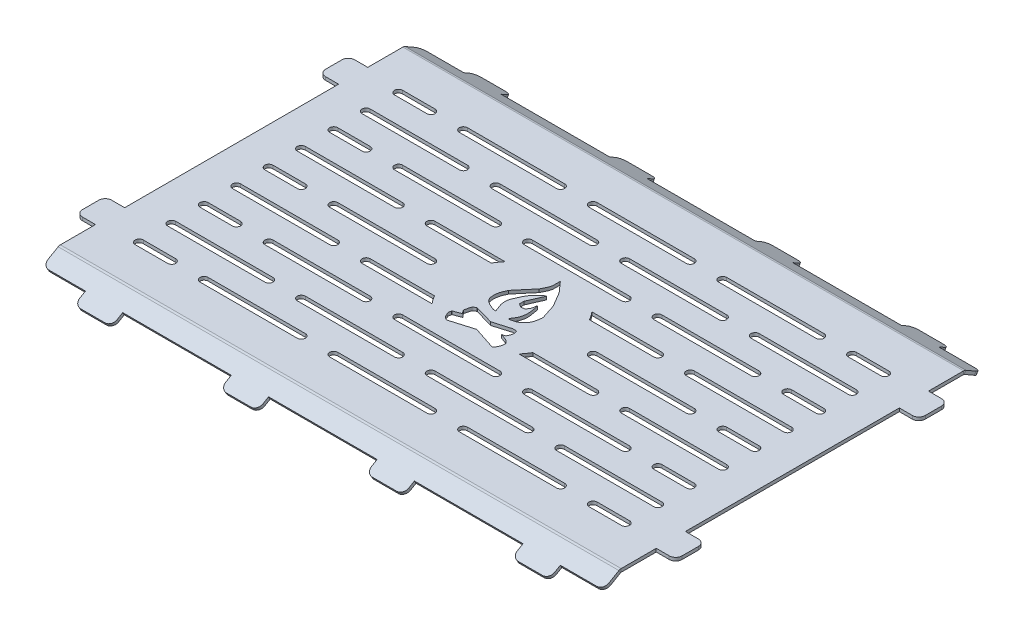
SolidWorks part; units mm, degrees
ref_plane "Ön Düzlem" through (0, 0, 0) normal (0, 0, 1) x (1, 0, 0)
ref_plane "Üst Düzlem" through (0, 0, 0) normal (0, 1, 0) x (1, 0, 0)
ref_plane "Sağ Düzlem" through (0, 0, 0) normal (1, 0, 0) x (0, 0, -1)
sketch "Çizim1" plane through (0, 0, 0) normal (0, 1, 0) x (1, 0, 0)
  line L1 (0, 0) -> (346, 0)
  line L2 (0, 0) -> (0, 237)
  line L3 (0, 237) -> (346, 237)
  line L4 (346, 0) -> (346, 237)
  dimension "D1" = 346
  dimension "D2" = 237
base flange "Taban-Flanş1" sketch "Çizim1" thickness 2 reverse thickness direction no parameters "D1"=0.7432
sketch "Çizim6" plane through (0, 0, 0) normal (0, 1, 0) x (1, 0, 0)
  line L0 (173, 237) -> (173, 0) construction
  line L1 (346, 237) -> (0, 237) construction
  line L2 (0, 0) -> (346, 0) construction
  line L3 (116.5, 237) -> (116.5, 245)
  line L4 (26.5, 237) -> (49.5, 237)
  line L5 (26.5, 237) -> (26.5, 245)
  line L6 (26.5, 245) -> (49.5, 245)
  line L7 (49.5, 237) -> (49.5, 245)
  line L8 (116.5, 237) -> (139.5, 237)
  line L9 (139.5, 237) -> (139.5, 245)
  line L10 (116.5, 245) -> (139.5, 245)
  line L11 (206.5, 237) -> (206.5, 245)
  line L12 (206.5, 237) -> (229.5, 237)
  line L13 (229.5, 237) -> (229.5, 245)
  line L14 (206.5, 245) -> (229.5, 245)
  line L15 (296.5, 237) -> (296.5, 245)
  line L16 (296.5, 237) -> (319.5, 237)
  line L17 (319.5, 237) -> (319.5, 245)
  line L18 (296.5, 245) -> (319.5, 245)
  line L19 (0, 237) -> (0, 0) construction
  line L20 (0, 202.5) -> (-12, 202.5)
  line L21 (0, 202.5) -> (0, 184.5)
  line L22 (0, 184.5) -> (-12, 184.5)
  line L23 (-12, 202.5) -> (-12, 184.5)
  line L24 (0, 118.5) -> (346, 118.5) construction
  line L25 (346, 0) -> (346, 237) construction
  line L26 (346, 184.5) -> (358, 184.5)
  line L27 (358, 202.5) -> (358, 184.5)
  line L28 (346, 202.5) -> (358, 202.5)
  line L29 (346, 202.5) -> (346, 184.5)
  line L30 (26.5, -8) -> (49.5, -8)
  line L31 (49.5, 0) -> (49.5, -8)
  line L32 (26.5, 0) -> (49.5, 0)
  line L33 (26.5, 0) -> (26.5, -8)
  line L34 (0, 52.5) -> (-12, 52.5)
  line L35 (-12, 34.5) -> (-12, 52.5)
  line L36 (0, 34.5) -> (-12, 34.5)
  line L37 (0, 34.5) -> (0, 52.5)
  line L38 (116.5, 0) -> (139.5, 0)
  line L39 (139.5, 0) -> (139.5, -8)
  line L40 (116.5, -8) -> (139.5, -8)
  line L41 (116.5, 0) -> (116.5, -8)
  line L42 (206.5, 0) -> (229.5, 0)
  line L43 (229.5, 0) -> (229.5, -8)
  line L44 (206.5, -8) -> (229.5, -8)
  line L45 (206.5, 0) -> (206.5, -8)
  line L46 (296.5, 0) -> (319.5, 0)
  line L47 (319.5, 0) -> (319.5, -8)
  line L48 (296.5, -8) -> (319.5, -8)
  line L49 (296.5, 0) -> (296.5, -8)
  line L50 (346, 34.5) -> (346, 52.5)
  line L51 (346, 34.5) -> (358, 34.5)
  line L52 (358, 34.5) -> (358, 52.5)
  line L53 (346, 52.5) -> (358, 52.5)
  point P10 (128, 245)
  point P11 (218, 245)
  point P34 (-12, 193.5)
  dimension "D1" = 23
  dimension "D2" = 8
  dimension "D4" = 90
  dimension "D5" = 45
  dimension "D6" = 18
  dimension "D7" = 12
  dimension "D8" = 150
  dimension "D3" = 4
base flange "Sekme1" sketch "Çizim6" thickness 2 reverse thickness direction no parameters "D1"=0.7432
break corner "Köşeleri kır1" thickness 2 parameters "D1"=4, "D0"=4, "D7"=5
sketch "Çizim9" plane through (0, 0, 0) normal (0, 1, 0) x (1, 0, 0)
  line L0 (0, 118.5) -> (346, 118.5) construction
  line L1 (0, 184.5) -> (0, 52.5) construction
  line L2 (346, 52.5) -> (346, 184.5) construction
  line L3 (173, 237) -> (173, 0) construction
  line L4 (206.5, 237) -> (139.5, 237) construction
  line L5 (139.5, 0) -> (206.5, 0) construction
  line L6 (296.5, 237) -> (229.5, 237) construction
  line L7 (30, 207) -> (316, 207) construction
  line L8 (30, 207) -> (30, 30) construction
  line L9 (30, 30) -> (316, 30) construction
  line L10 (316, 207) -> (316, 30) construction
  line L11 (30, 207) -> (316, 30) construction
  line L12 (30, 30) -> (316, 207) construction
  line L13 (30, 167) -> (70, 207) construction
  line L14 (26.4645, 170.5355) -> (66.4645, 210.5355)
  line L15 (33.5355, 163.4645) -> (73.5355, 203.4645)
  line L16 (79.2, 167) -> (119.2, 207) construction
  line L17 (75.6645, 170.5355) -> (115.6645, 210.5355)
  line L18 (82.7355, 163.4645) -> (122.7355, 203.4645)
  line L19 (128.4, 167) -> (168.4, 207) construction
  line L20 (124.8645, 170.5355) -> (164.8645, 210.5355)
  line L21 (131.9355, 163.4645) -> (171.9355, 203.4645)
  line L22 (177.6, 167) -> (217.6, 207) construction
  line L23 (174.0645, 170.5355) -> (214.0645, 210.5355)
  line L24 (181.1355, 163.4645) -> (221.1355, 203.4645)
  line L25 (226.8, 167) -> (266.8, 207) construction
  line L26 (223.2645, 170.5355) -> (263.2645, 210.5355)
  line L27 (230.3355, 163.4645) -> (270.3355, 203.4645)
  line L28 (276, 167) -> (316, 207) construction
  line L29 (272.4645, 170.5355) -> (312.4645, 210.5355)
  line L30 (279.5355, 163.4645) -> (319.5355, 203.4645)
  line L31 (30, 70) -> (70, 30) construction
  line L32 (26.4645, 66.4645) -> (66.4645, 26.4645)
  line L33 (33.5355, 73.5355) -> (73.5355, 33.5355)
  line L34 (79.2, 70) -> (119.2, 30) construction
  line L35 (75.6645, 66.4645) -> (115.6645, 26.4645)
  line L36 (82.7355, 73.5355) -> (122.7355, 33.5355)
  line L37 (128.4, 70) -> (168.4, 30) construction
  line L38 (124.8645, 66.4645) -> (164.8645, 26.4645)
  line L39 (131.9355, 73.5355) -> (171.9355, 33.5355)
  line L40 (177.6, 70) -> (217.6, 30) construction
  line L41 (174.0645, 66.4645) -> (214.0645, 26.4645)
  line L42 (181.1355, 73.5355) -> (221.1355, 33.5355)
  line L43 (226.8, 70) -> (266.8, 30) construction
  line L44 (223.2645, 66.4645) -> (263.2645, 26.4645)
  line L45 (230.3355, 73.5355) -> (270.3355, 33.5355)
  line L46 (276, 70) -> (316, 30) construction
  line L47 (272.4645, 66.4645) -> (312.4645, 26.4645)
  line L48 (279.5355, 73.5355) -> (319.5355, 33.5355)
  line L57 (30, 138.5) -> (50, 118.5) construction
  line L58 (50, 118.5) -> (30, 98.5) construction
  line L59 (30, 98.5) -> (30, 138.5) construction
  line L60 (33.5355, 142.0355) -> (53.5355, 122.0355)
  line L61 (26.4645, 134.9645) -> (39.3934, 122.0355)
  line L62 (33.5355, 94.9645) -> (53.5355, 114.9645)
  line L63 (26.4645, 102.0355) -> (39.3934, 114.9645)
  line L64 (86.7355, 94.9645) -> (106.7355, 114.9645)
  line L65 (79.6645, 102.0355) -> (92.5934, 114.9645)
  line L66 (79.6645, 134.9645) -> (92.5934, 122.0355)
  line L67 (86.7355, 142.0355) -> (106.7355, 122.0355)
  line L68 (139.9355, 94.9645) -> (159.9355, 114.9645)
  line L69 (132.8645, 102.0355) -> (145.7934, 114.9645)
  line L70 (132.8645, 134.9645) -> (145.7934, 122.0355)
  line L71 (139.9355, 142.0355) -> (159.9355, 122.0355)
  line L72 (193.1355, 94.9645) -> (213.1355, 114.9645)
  line L73 (186.0645, 102.0355) -> (198.9934, 114.9645)
  line L74 (186.0645, 134.9645) -> (198.9934, 122.0355)
  line L75 (193.1355, 142.0355) -> (213.1355, 122.0355)
  line L76 (246.3355, 94.9645) -> (266.3355, 114.9645) construction
  line L77 (239.2645, 102.0355) -> (252.1934, 114.9645) construction
  line L78 (239.2645, 134.9645) -> (252.1934, 122.0355) construction
  line L79 (246.3355, 142.0355) -> (266.3355, 122.0355) construction
  line L80 (299.5355, 94.9645) -> (319.5355, 114.9645) construction
  line L81 (292.4645, 102.0355) -> (305.3934, 114.9645) construction
  line L82 (292.4645, 134.9645) -> (305.3934, 122.0355) construction
  line L83 (299.5355, 142.0355) -> (319.5355, 122.0355) construction
  line L84 (266.3355, 102.0355) -> (253.4066, 114.9645)
  line L85 (266.3355, 134.9645) -> (253.4066, 122.0355)
  line L86 (259.2645, 142.0355) -> (239.2645, 122.0355)
  line L87 (259.2645, 94.9645) -> (239.2645, 114.9645)
  line L88 (312.4645, 142.0355) -> (292.4645, 122.0355)
  line L89 (319.5355, 134.9645) -> (306.6066, 122.0355)
  line L90 (319.5355, 102.0355) -> (306.6066, 114.9645)
  line L91 (312.4645, 94.9645) -> (292.4645, 114.9645)
  arc A0 (26.4645, 170.5355) -> (33.5355, 163.4645) centre (30, 167) ccw
  arc A1 (73.5355, 203.4645) -> (66.4645, 210.5355) centre (70, 207) ccw
  arc A2 (75.6645, 170.5355) -> (82.7355, 163.4645) centre (79.2, 167) ccw
  arc A3 (122.7355, 203.4645) -> (115.6645, 210.5355) centre (119.2, 207) ccw
  arc A4 (124.8645, 170.5355) -> (131.9355, 163.4645) centre (128.4, 167) ccw
  arc A5 (171.9355, 203.4645) -> (164.8645, 210.5355) centre (168.4, 207) ccw
  arc A6 (174.0645, 170.5355) -> (181.1355, 163.4645) centre (177.6, 167) ccw
  arc A7 (221.1355, 203.4645) -> (214.0645, 210.5355) centre (217.6, 207) ccw
  arc A8 (223.2645, 170.5355) -> (230.3355, 163.4645) centre (226.8, 167) ccw
  arc A9 (270.3355, 203.4645) -> (263.2645, 210.5355) centre (266.8, 207) ccw
  arc A10 (272.4645, 170.5355) -> (279.5355, 163.4645) centre (276, 167) ccw
  arc A11 (319.5355, 203.4645) -> (312.4645, 210.5355) centre (316, 207) ccw
  arc A12 (26.4645, 66.4645) -> (33.5355, 73.5355) centre (30, 70) cw
  arc A13 (73.5355, 33.5355) -> (66.4645, 26.4645) centre (70, 30) cw
  arc A14 (75.6645, 66.4645) -> (82.7355, 73.5355) centre (79.2, 70) cw
  arc A15 (122.7355, 33.5355) -> (115.6645, 26.4645) centre (119.2, 30) cw
  arc A16 (124.8645, 66.4645) -> (131.9355, 73.5355) centre (128.4, 70) cw
  arc A17 (171.9355, 33.5355) -> (164.8645, 26.4645) centre (168.4, 30) cw
  arc A18 (174.0645, 66.4645) -> (181.1355, 73.5355) centre (177.6, 70) cw
  arc A19 (221.1355, 33.5355) -> (214.0645, 26.4645) centre (217.6, 30) cw
  arc A20 (223.2645, 66.4645) -> (230.3355, 73.5355) centre (226.8, 70) cw
  arc A21 (270.3355, 33.5355) -> (263.2645, 26.4645) centre (266.8, 30) cw
  arc A22 (272.4645, 66.4645) -> (279.5355, 73.5355) centre (276, 70) cw
  arc A23 (319.5355, 33.5355) -> (312.4645, 26.4645) centre (316, 30) cw
  circle A28 centre (30, 138.5) radius 5 construction
  circle A29 centre (50, 118.5) radius 5 construction
  arc A30 (26.4645, 134.9645) -> (33.5355, 142.0355) centre (30, 138.5) cw
  arc A31 (26.4645, 102.0355) -> (33.5355, 94.9645) centre (30, 98.5) ccw
  arc A32 (53.5355, 122.0355) -> (53.5355, 114.9645) centre (50, 118.5) cw
  arc A33 (39.3934, 114.9645) -> (39.3934, 122.0355) centre (35.8579, 118.5) ccw
  arc A34 (106.7355, 122.0355) -> (106.7355, 114.9645) centre (103.2, 118.5) cw
  arc A35 (79.6645, 102.0355) -> (86.7355, 94.9645) centre (83.2, 98.5) ccw
  arc A36 (92.5934, 114.9645) -> (92.5934, 122.0355) centre (89.0579, 118.5) ccw
  arc A37 (79.6645, 134.9645) -> (86.7355, 142.0355) centre (83.2, 138.5) cw
  arc A38 (159.9355, 122.0355) -> (159.9355, 114.9645) centre (156.4, 118.5) cw
  arc A39 (132.8645, 102.0355) -> (139.9355, 94.9645) centre (136.4, 98.5) ccw
  arc A40 (145.7934, 114.9645) -> (145.7934, 122.0355) centre (142.2579, 118.5) ccw
  arc A41 (132.8645, 134.9645) -> (139.9355, 142.0355) centre (136.4, 138.5) cw
  arc A42 (213.1355, 122.0355) -> (213.1355, 114.9645) centre (209.6, 118.5) cw
  arc A43 (186.0645, 102.0355) -> (193.1355, 94.9645) centre (189.6, 98.5) ccw
  arc A44 (198.9934, 114.9645) -> (198.9934, 122.0355) centre (195.4579, 118.5) ccw
  arc A45 (186.0645, 134.9645) -> (193.1355, 142.0355) centre (189.6, 138.5) cw
  arc A46 (266.3355, 122.0355) -> (266.3355, 114.9645) centre (262.8, 118.5) cw construction
  arc A47 (239.2645, 102.0355) -> (246.3355, 94.9645) centre (242.8, 98.5) ccw construction
  arc A48 (252.1934, 114.9645) -> (252.1934, 122.0355) centre (248.6579, 118.5) ccw construction
  arc A49 (239.2645, 134.9645) -> (246.3355, 142.0355) centre (242.8, 138.5) cw construction
  arc A50 (319.5355, 122.0355) -> (319.5355, 114.9645) centre (316, 118.5) cw construction
  arc A51 (292.4645, 102.0355) -> (299.5355, 94.9645) centre (296, 98.5) ccw construction
  arc A52 (305.3934, 114.9645) -> (305.3934, 122.0355) centre (301.8579, 118.5) ccw construction
  arc A53 (292.4645, 134.9645) -> (299.5355, 142.0355) centre (296, 138.5) cw construction
  arc A54 (266.3355, 102.0355) -> (259.2645, 94.9645) centre (262.8, 98.5) cw
  arc A55 (253.4066, 114.9645) -> (253.4066, 122.0355) centre (256.9421, 118.5) cw
  arc A56 (266.3355, 134.9645) -> (259.2645, 142.0355) centre (262.8, 138.5) ccw
  arc A57 (239.2645, 122.0355) -> (239.2645, 114.9645) centre (242.8, 118.5) ccw
  arc A58 (319.5355, 134.9645) -> (312.4645, 142.0355) centre (316, 138.5) ccw
  arc A59 (306.6066, 114.9645) -> (306.6066, 122.0355) centre (310.1421, 118.5) cw
  arc A60 (319.5355, 102.0355) -> (312.4645, 94.9645) centre (316, 98.5) cw
  arc A61 (292.4645, 122.0355) -> (292.4645, 114.9645) centre (296, 118.5) ccw
  point P12 (173, 118.5)
  point P21 (50, 187)
  point P30 (99.2, 187)
  point P37 (148.4, 187)
  point P44 (197.6, 187)
  point P51 (246.8, 187)
  point P58 (296, 187)
  point P64 (50, 50)
  point P71 (99.2, 50)
  point P78 (148.4, 50)
  point P85 (197.6, 50)
  point P92 (246.8, 50)
  point P98 (296, 50)
  point P118 (42.9289, 118.5)
  point P183 (316, 118.5)
  dimension "D5" = 5
  dimension "D7" = 10
  dimension "D9" = 5
  dimension "D1" = 30
  dimension "D2" = 30
  dimension "D3" = 40
  dimension "D4" = 40
  dimension "D8" = 40
  dimension "D6" = 6
  dimension "D10" = 6
extrude "Kes-Ekstrüzyon1" cut sketch "Çizim9" against normal blind 10
sketch "Çizim10" plane through (0, 0, 0) normal (0, 1, 0) x (1, 0, 0)
  line L0 (346, 52.5) -> (346, 184.5) construction
  line L1 (125, 152) -> (221, 152)
  line L2 (125, 152) -> (125, 85)
  line L3 (125, 85) -> (221, 85)
  line L4 (221, 152) -> (221, 85)
  line L5 (0, 184.5) -> (0, 52.5) construction
  line L6 (206.5, 237) -> (139.5, 237) construction
  line L7 (139.5, 0) -> (206.5, 0) construction
  dimension "D1" = 125
  dimension "D2" = 125
  dimension "D3" = 85
  dimension "D4" = 85
base flange "Sekme2" sketch "Çizim10" thickness 2 reverse thickness direction no parameters "D1"=0.7432
sketch "Çizim13" plane through (0, 0, 0) normal (0, 1, 0) x (1, 0, 0)
  line L8 (0, 118.5) -> (346, 118.5) construction
  line L9 (0, 184.5) -> (0, 52.5) construction
  line L10 (346, 52.5) -> (346, 184.5) construction
  line L11 (173, 237) -> (173, 0) construction
  line L12 (206.5, 237) -> (139.5, 237) construction
  line L13 (139.5, 0) -> (206.5, 0) construction
  line L14 (173, 118.5) -> (197.7487, 143.2487) construction
  line L15 (173, 118.5) -> (184.9707, 151.3892) construction
  circle A5 centre (173, 118.5) radius 35 construction
  arc A6 (205.8892, 130.4707) -> (184.9707, 151.3892) centre (173, 118.5) ccw construction
  arc A11 (207.7686, 131.1547) -> (185.6547, 153.2686) centre (173, 118.5) ccw
  arc A12 (204.0099, 129.7867) -> (184.2867, 149.5099) centre (173, 118.5) ccw
  arc A13 (204.0099, 129.7867) -> (207.7686, 131.1547) centre (205.8892, 130.4707) ccw
  arc A14 (185.6547, 153.2686) -> (184.2867, 149.5099) centre (184.9707, 151.3892) ccw
  arc A15 (184.9707, 85.6108) -> (205.8892, 106.5293) centre (173, 118.5) ccw construction
  arc A16 (185.6547, 83.7314) -> (207.7686, 105.8453) centre (173, 118.5) ccw
  arc A17 (184.2867, 87.4901) -> (204.0099, 107.2133) centre (173, 118.5) ccw
  arc A18 (184.2867, 87.4901) -> (185.6547, 83.7314) centre (184.9707, 85.6108) ccw
  arc A19 (207.7686, 105.8453) -> (204.0099, 107.2133) centre (205.8892, 106.5293) ccw
  arc A20 (140.1108, 106.5293) -> (161.0293, 85.6108) centre (173, 118.5) ccw construction
  arc A21 (138.2314, 105.8453) -> (160.3453, 83.7314) centre (173, 118.5) ccw
  arc A22 (141.9901, 107.2133) -> (161.7133, 87.4901) centre (173, 118.5) ccw
  arc A23 (141.9901, 107.2133) -> (138.2314, 105.8453) centre (140.1108, 106.5293) ccw
  arc A24 (160.3453, 83.7314) -> (161.7133, 87.4901) centre (161.0293, 85.6108) ccw
  arc A25 (161.0293, 151.3892) -> (140.1108, 130.4707) centre (173, 118.5) ccw construction
  arc A26 (160.3453, 153.2686) -> (138.2314, 131.1547) centre (173, 118.5) ccw
  arc A27 (161.7133, 149.5099) -> (141.9901, 129.7867) centre (173, 118.5) ccw
  arc A28 (161.7133, 149.5099) -> (160.3453, 153.2686) centre (161.0293, 151.3892) ccw
  arc A29 (138.2314, 131.1547) -> (141.9901, 129.7867) centre (140.1108, 130.4707) ccw
  point P17 (197.7487, 143.2487)
  point P25 (173, 118.5)
  point P30 (197.7487, 93.7513)
  point P37 (148.2513, 93.7513)
  point P44 (148.2513, 143.2487)
  point P49 (173, 118.5)
  dimension "D1" = 70
  dimension "D2" = 45
  dimension "D3" = 2
  dimension "D4" = 25
  dimension "D5" = 4
sketch_block_instance "Blok1-1"
sketch_block "Blok1" parameters "D1"=3
extrude "Kes-Ekstrüzyon2" [suppressed] cut sketch "Çizim13" against normal blind 10
sketch "Çizim15" plane through (0, 0, 0) normal (0, 1, 0) x (1, 0, 0)
  line L0 (0, 118.5) -> (346, 118.5) construction
  line L1 (0, 184.5) -> (0, 52.5) construction
  line L2 (346, 52.5) -> (346, 184.5) construction
  line L3 (173, 237) -> (173, 0) construction
  line L4 (206.5, 237) -> (139.5, 237) construction
  line L5 (139.5, 0) -> (206.5, 0) construction
  line L6 (173, 118.5) -> (211.3022, 86.3606) construction
  circle A0 centre (173, 118.5) radius 50 construction
  arc A1 (211.3022, 86.3606) -> (211.3022, 150.6394) centre (173, 118.5) ccw construction
  arc A2 (213.2173, 84.7537) -> (213.2173, 152.2463) centre (173, 118.5) ccw
  arc A3 (209.3871, 87.9676) -> (209.3871, 149.0324) centre (173, 118.5) ccw
  arc A4 (209.3871, 87.9676) -> (213.2173, 84.7537) centre (211.3022, 86.3606) ccw
  arc A5 (213.2173, 152.2463) -> (209.3871, 149.0324) centre (211.3022, 150.6394) ccw
  arc A6 (134.6978, 86.3606) -> (134.6978, 150.6394) centre (173, 118.5) cw construction
  arc A7 (132.7827, 84.7537) -> (132.7827, 152.2463) centre (173, 118.5) cw
  arc A8 (136.6129, 87.9676) -> (136.6129, 149.0324) centre (173, 118.5) cw
  arc A9 (136.6129, 87.9676) -> (132.7827, 84.7537) centre (134.6978, 86.3606) cw
  arc A10 (132.7827, 152.2463) -> (136.6129, 149.0324) centre (134.6978, 150.6394) cw
  point P16 (223, 118.5)
  point P24 (123, 118.5)
  dimension "D1" = 100
  dimension "D2" = 2.5
  dimension "D3" = 40
extrude "Kes-Ekstrüzyon4" [suppressed] cut sketch "Çizim15" against normal blind 10
sketch "Çizim14" plane through (0, 0, 0) normal (0, 1, 0) x (1, 0, 0)
  line L0 (0, 118.5) -> (346, 118.5) construction
  line L1 (0, 0) -> (0, 237) construction
  line L2 (346, 52.5) -> (346, 184.5) construction
  line L3 (15, 153.5) -> (15, 83.5) construction
  line L4 (0, 184.5) -> (0, 52.5) construction
  line L5 (173, 237) -> (173, 0) construction
  line L6 (206.5, 237) -> (139.5, 237) construction
  line L7 (139.5, 0) -> (206.5, 0) construction
  circle A0 centre (15, 153.5) radius 4
  circle A1 centre (15, 83.5) radius 4
  circle A2 centre (331, 153.5) radius 4
  circle A3 centre (331, 83.5) radius 4
  point P9 (15, 118.5)
  dimension "D1" = 8
  dimension "D3" = 15
  dimension "D2" = 70
extrude "Kes-Ekstrüzyon3" [suppressed] cut sketch "Çizim14" against normal blind 10
sketch "Çizim16" plane through (0, 0, 0) normal (0, 1, 0) x (1, 0, 0)
  line L1 (22.8543, 224.6637) -> (329.0665, 224.6637)
  line L2 (22.8543, 224.6637) -> (22.8543, 159.7932)
  line L3 (22.8543, 159.7932) -> (329.0665, 159.7932)
  line L4 (329.0665, 224.6637) -> (329.0665, 159.7932)
  line L5 (22.8543, 78.4429) -> (324.2831, 78.4429)
  line L6 (22.8543, 78.4429) -> (22.8543, 17.605)
  line L7 (22.8543, 17.605) -> (324.2831, 17.605)
  line L8 (324.2831, 78.4429) -> (324.2831, 17.605)
  line L9 (233.0263, 152.2314) -> (324.2831, 152.2314)
  line L10 (233.0263, 152.2314) -> (233.0263, 86.8759)
  line L11 (233.0263, 86.8759) -> (324.2831, 86.8759)
  line L12 (324.2831, 152.2314) -> (324.2831, 86.8759)
  line L13 (22.8543, 148.3161) -> (109.8446, 148.3161)
  line L14 (22.8543, 148.3161) -> (22.8543, 90.7912)
  line L15 (22.8543, 90.7912) -> (109.8446, 90.7912)
  line L16 (109.8446, 148.3161) -> (109.8446, 90.7912)
base flange "Sekme3" sketch "Çizim16" thickness 2 reverse thickness direction no parameters "D1"=0.7432
sketch "Çizim19" plane through (0, 0, 0) normal (0, 1, 0) x (1, 0, 0)
  line L0 (23, 218.5) -> (83, 218.5) construction
  line L1 (23, 221) -> (83, 221)
  line L2 (23, 216) -> (83, 216)
  line L3 (103, 218.5) -> (163, 218.5) construction
  line L4 (103, 221) -> (163, 221)
  line L5 (103, 216) -> (163, 216)
  line L6 (183, 218.5) -> (243, 218.5) construction
  line L7 (183, 221) -> (243, 221)
  line L8 (183, 216) -> (243, 216)
  line L9 (263, 218.5) -> (323, 218.5) construction
  line L10 (263, 221) -> (323, 221)
  line L11 (263, 216) -> (323, 216)
  line L12 (173, 237) -> (173, 0) construction
  line L13 (206.5, 237) -> (139.5, 237) construction
  line L14 (139.5, 0) -> (206.5, 0) construction
  line L15 (0, 118.5) -> (346, 118.5) construction
  line L16 (0, 184.5) -> (0, 52.5) construction
  line L17 (346, 52.5) -> (346, 184.5) construction
  line L18 (63, 198.5) -> (123, 198.5) construction
  line L19 (63, 201) -> (123, 201)
  line L20 (63, 196) -> (123, 196)
  line L21 (143, 198.5) -> (203, 198.5) construction
  line L22 (143, 201) -> (203, 201)
  line L23 (143, 196) -> (203, 196)
  line L24 (223, 198.5) -> (283, 198.5) construction
  line L25 (223, 201) -> (283, 201)
  line L26 (223, 196) -> (283, 196)
  line L27 (23, 178.5) -> (83, 178.5) construction
  line L30 (83, 218.5) -> (103, 218.5) construction
  line L31 (93, 218.5) -> (93, 198.5) construction
  line L32 (23, 181) -> (83, 181)
  line L33 (23, 176) -> (83, 176)
  line L34 (103, 178.5) -> (163, 178.5) construction
  line L35 (103, 181) -> (163, 181)
  line L36 (103, 176) -> (163, 176)
  line L37 (183, 178.5) -> (243, 178.5) construction
  line L38 (183, 181) -> (243, 181)
  line L39 (183, 176) -> (243, 176)
  line L40 (263, 178.5) -> (323, 178.5) construction
  line L41 (263, 181) -> (323, 181)
  line L42 (263, 176) -> (323, 176)
  line L43 (63, 158.5) -> (123, 158.5) construction
  line L44 (63, 161) -> (123, 161)
  line L45 (63, 156) -> (123, 156)
  line L46 (143, 158.5) -> (203, 158.5) construction
  line L47 (143, 161) -> (203, 161)
  line L48 (143, 156) -> (203, 156)
  line L49 (223, 158.5) -> (283, 158.5) construction
  line L50 (223, 161) -> (283, 161)
  line L51 (223, 156) -> (283, 156)
  line L52 (23, 138.5) -> (83, 138.5) construction
  line L53 (23, 141) -> (83, 141)
  line L54 (23, 136) -> (83, 136)
  line L55 (103, 138.5) -> (163, 138.5) construction
  line L56 (103, 141) -> (163, 141)
  line L57 (103, 136) -> (163, 136)
  line L58 (183, 138.5) -> (243, 138.5) construction
  line L59 (183, 141) -> (243, 141)
  line L60 (183, 136) -> (243, 136)
  line L61 (263, 138.5) -> (323, 138.5) construction
  line L62 (263, 141) -> (323, 141)
  line L63 (263, 136) -> (323, 136)
  line L64 (63, 118.5) -> (123, 118.5) construction
  line L65 (63, 121) -> (123, 121)
  line L66 (63, 116) -> (123, 116)
  line L67 (143, 118.5) -> (203, 118.5) construction
  line L68 (143, 121) -> (203, 121)
  line L69 (143, 116) -> (203, 116)
  line L70 (223, 118.5) -> (283, 118.5) construction
  line L71 (223, 121) -> (283, 121)
  line L72 (223, 116) -> (283, 116)
  line L73 (23, 98.5) -> (83, 98.5) construction
  line L74 (23, 101) -> (83, 101)
  line L75 (23, 96) -> (83, 96)
  line L76 (103, 98.5) -> (163, 98.5) construction
  line L77 (103, 101) -> (163, 101)
  line L78 (103, 96) -> (163, 96)
  line L79 (183, 98.5) -> (243, 98.5) construction
  line L80 (183, 101) -> (243, 101)
  line L81 (183, 96) -> (243, 96)
  line L82 (263, 98.5) -> (323, 98.5) construction
  line L83 (263, 101) -> (323, 101)
  line L84 (263, 96) -> (323, 96)
  line L85 (63, 78.5) -> (123, 78.5) construction
  line L86 (63, 81) -> (123, 81)
  line L87 (63, 76) -> (123, 76)
  line L88 (143, 78.5) -> (203, 78.5) construction
  line L89 (143, 81) -> (203, 81)
  line L90 (143, 76) -> (203, 76)
  line L91 (223, 78.5) -> (283, 78.5) construction
  line L92 (223, 81) -> (283, 81)
  line L93 (223, 76) -> (283, 76)
  line L94 (23, 58.5) -> (83, 58.5) construction
  line L95 (23, 61) -> (83, 61)
  line L96 (23, 56) -> (83, 56)
  line L97 (103, 58.5) -> (163, 58.5) construction
  line L98 (103, 61) -> (163, 61)
  line L99 (103, 56) -> (163, 56)
  line L100 (183, 58.5) -> (243, 58.5) construction
  line L101 (183, 61) -> (243, 61)
  line L102 (183, 56) -> (243, 56)
  line L103 (263, 58.5) -> (323, 58.5) construction
  line L104 (263, 61) -> (323, 61)
  line L105 (263, 56) -> (323, 56)
  line L106 (63, 38.5) -> (123, 38.5) construction
  line L107 (63, 41) -> (123, 41)
  line L108 (63, 36) -> (123, 36)
  line L109 (143, 38.5) -> (203, 38.5) construction
  line L110 (143, 41) -> (203, 41)
  line L111 (143, 36) -> (203, 36)
  line L112 (223, 38.5) -> (283, 38.5) construction
  line L113 (223, 41) -> (283, 41)
  line L114 (223, 36) -> (283, 36)
  line L115 (23, 18.5) -> (83, 18.5) construction
  line L116 (23, 21) -> (83, 21)
  line L117 (23, 16) -> (83, 16)
  line L118 (103, 18.5) -> (163, 18.5) construction
  line L119 (103, 21) -> (163, 21)
  line L120 (103, 16) -> (163, 16)
  line L121 (183, 18.5) -> (243, 18.5) construction
  line L122 (183, 21) -> (243, 21)
  line L123 (183, 16) -> (243, 16)
  line L124 (263, 18.5) -> (323, 18.5) construction
  line L125 (263, 21) -> (323, 21)
  line L126 (263, 16) -> (323, 16)
  line L143 (116.5, 237) -> (49.5, 237) construction
  line L234 (143, -1.5) -> (203, -1.5) construction
  line L235 (143, 3.5) -> (203, 3.5)
  line L236 (143, -6.5) -> (203, -6.5)
  line L237 (223, -1.5) -> (283, -1.5) construction
  line L238 (223, 3.5) -> (283, 3.5)
  line L239 (223, -6.5) -> (283, -6.5)
  line L240 (63, -1.5) -> (123, -1.5) construction
  line L241 (63, 3.5) -> (123, 3.5)
  line L242 (63, -6.5) -> (123, -6.5)
  line L243 (143, -1.5) -> (203, -1.5) construction
  line L244 (143, 1) -> (203, 1)
  line L245 (143, -4) -> (203, -4)
  line L246 (223, -1.5) -> (283, -1.5) construction
  line L247 (223, 1) -> (283, 1)
  line L248 (223, -4) -> (283, -4)
  line L249 (63, -1.5) -> (123, -1.5) construction
  line L250 (63, 1) -> (123, 1)
  line L251 (63, -4) -> (123, -4)
  arc A0 (23, 221) -> (23, 216) centre (23, 218.5) ccw
  arc A1 (83, 216) -> (83, 221) centre (83, 218.5) ccw
  arc A2 (103, 221) -> (103, 216) centre (103, 218.5) ccw
  arc A3 (163, 216) -> (163, 221) centre (163, 218.5) ccw
  arc A4 (183, 221) -> (183, 216) centre (183, 218.5) ccw
  arc A5 (243, 216) -> (243, 221) centre (243, 218.5) ccw
  arc A6 (263, 221) -> (263, 216) centre (263, 218.5) ccw
  arc A7 (323, 216) -> (323, 221) centre (323, 218.5) ccw
  arc A8 (63, 201) -> (63, 196) centre (63, 198.5) ccw
  arc A9 (123, 196) -> (123, 201) centre (123, 198.5) ccw
  arc A10 (143, 201) -> (143, 196) centre (143, 198.5) ccw
  arc A11 (203, 196) -> (203, 201) centre (203, 198.5) ccw
  arc A12 (223, 201) -> (223, 196) centre (223, 198.5) ccw
  arc A13 (283, 196) -> (283, 201) centre (283, 198.5) ccw
  arc A16 (23, 181) -> (23, 176) centre (23, 178.5) ccw
  arc A17 (83, 176) -> (83, 181) centre (83, 178.5) ccw
  arc A18 (103, 181) -> (103, 176) centre (103, 178.5) ccw
  arc A19 (163, 176) -> (163, 181) centre (163, 178.5) ccw
  arc A20 (183, 181) -> (183, 176) centre (183, 178.5) ccw
  arc A21 (243, 176) -> (243, 181) centre (243, 178.5) ccw
  arc A22 (263, 181) -> (263, 176) centre (263, 178.5) ccw
  arc A23 (323, 176) -> (323, 181) centre (323, 178.5) ccw
  arc A24 (63, 161) -> (63, 156) centre (63, 158.5) ccw
  arc A25 (123, 156) -> (123, 161) centre (123, 158.5) ccw
  arc A26 (143, 161) -> (143, 156) centre (143, 158.5) ccw
  arc A27 (203, 156) -> (203, 161) centre (203, 158.5) ccw
  arc A28 (223, 161) -> (223, 156) centre (223, 158.5) ccw
  arc A29 (283, 156) -> (283, 161) centre (283, 158.5) ccw
  arc A30 (23, 141) -> (23, 136) centre (23, 138.5) ccw
  arc A31 (83, 136) -> (83, 141) centre (83, 138.5) ccw
  arc A32 (103, 141) -> (103, 136) centre (103, 138.5) ccw
  arc A33 (163, 136) -> (163, 141) centre (163, 138.5) ccw
  arc A34 (183, 141) -> (183, 136) centre (183, 138.5) ccw
  arc A35 (243, 136) -> (243, 141) centre (243, 138.5) ccw
  arc A36 (263, 141) -> (263, 136) centre (263, 138.5) ccw
  arc A37 (323, 136) -> (323, 141) centre (323, 138.5) ccw
  arc A38 (63, 121) -> (63, 116) centre (63, 118.5) ccw
  arc A39 (123, 116) -> (123, 121) centre (123, 118.5) ccw
  arc A40 (143, 121) -> (143, 116) centre (143, 118.5) ccw
  arc A41 (203, 116) -> (203, 121) centre (203, 118.5) ccw
  arc A42 (223, 121) -> (223, 116) centre (223, 118.5) ccw
  arc A43 (283, 116) -> (283, 121) centre (283, 118.5) ccw
  arc A44 (23, 101) -> (23, 96) centre (23, 98.5) ccw
  arc A45 (83, 96) -> (83, 101) centre (83, 98.5) ccw
  arc A46 (103, 101) -> (103, 96) centre (103, 98.5) ccw
  arc A47 (163, 96) -> (163, 101) centre (163, 98.5) ccw
  arc A48 (183, 101) -> (183, 96) centre (183, 98.5) ccw
  arc A49 (243, 96) -> (243, 101) centre (243, 98.5) ccw
  arc A50 (263, 101) -> (263, 96) centre (263, 98.5) ccw
  arc A51 (323, 96) -> (323, 101) centre (323, 98.5) ccw
  arc A52 (63, 81) -> (63, 76) centre (63, 78.5) ccw
  arc A53 (123, 76) -> (123, 81) centre (123, 78.5) ccw
  arc A54 (143, 81) -> (143, 76) centre (143, 78.5) ccw
  arc A55 (203, 76) -> (203, 81) centre (203, 78.5) ccw
  arc A56 (223, 81) -> (223, 76) centre (223, 78.5) ccw
  arc A57 (283, 76) -> (283, 81) centre (283, 78.5) ccw
  arc A58 (23, 61) -> (23, 56) centre (23, 58.5) ccw
  arc A59 (83, 56) -> (83, 61) centre (83, 58.5) ccw
  arc A60 (103, 61) -> (103, 56) centre (103, 58.5) ccw
  arc A61 (163, 56) -> (163, 61) centre (163, 58.5) ccw
  arc A62 (183, 61) -> (183, 56) centre (183, 58.5) ccw
  arc A63 (243, 56) -> (243, 61) centre (243, 58.5) ccw
  arc A64 (263, 61) -> (263, 56) centre (263, 58.5) ccw
  arc A65 (323, 56) -> (323, 61) centre (323, 58.5) ccw
  arc A66 (63, 41) -> (63, 36) centre (63, 38.5) ccw
  arc A67 (123, 36) -> (123, 41) centre (123, 38.5) ccw
  arc A68 (143, 41) -> (143, 36) centre (143, 38.5) ccw
  arc A69 (203, 36) -> (203, 41) centre (203, 38.5) ccw
  arc A70 (223, 41) -> (223, 36) centre (223, 38.5) ccw
  arc A71 (283, 36) -> (283, 41) centre (283, 38.5) ccw
  arc A72 (23, 21) -> (23, 16) centre (23, 18.5) ccw
  arc A73 (83, 16) -> (83, 21) centre (83, 18.5) ccw
  arc A74 (103, 21) -> (103, 16) centre (103, 18.5) ccw
  arc A75 (163, 16) -> (163, 21) centre (163, 18.5) ccw
  arc A76 (183, 21) -> (183, 16) centre (183, 18.5) ccw
  arc A77 (243, 16) -> (243, 21) centre (243, 18.5) ccw
  arc A78 (263, 21) -> (263, 16) centre (263, 18.5) ccw
  arc A79 (323, 16) -> (323, 21) centre (323, 18.5) ccw
  arc A158 (143, 1) -> (143, -4) centre (143, -1.5) ccw
  arc A159 (203, -4) -> (203, 1) centre (203, -1.5) ccw
  arc A160 (223, 1) -> (223, -4) centre (223, -1.5) ccw
  arc A161 (283, -4) -> (283, 1) centre (283, -1.5) ccw
  arc A162 (63, 1) -> (63, -4) centre (63, -1.5) ccw
  arc A163 (123, -4) -> (123, 1) centre (123, -1.5) ccw
  point P2 (53, 218.5)
  point P10 (133, 218.5)
  point P17 (213, 218.5)
  point P23 (293, 218.5)
  point P43 (93, 198.5)
  point P51 (173, 198.5)
  point P58 (253, 198.5)
  point P66 (53, 178.5)
  point P77 (133, 178.5)
  point P84 (213, 178.5)
  point P90 (293, 178.5)
  point P97 (93, 158.5)
  point P104 (173, 158.5)
  point P111 (253, 158.5)
  point P118 (53, 138.5)
  point P126 (133, 138.5)
  point P133 (213, 138.5)
  point P139 (293, 138.5)
  point P146 (93, 118.5)
  point P153 (173, 118.5)
  point P160 (253, 118.5)
  point P167 (53, 98.5)
  point P175 (133, 98.5)
  point P182 (213, 98.5)
  point P188 (293, 98.5)
  point P195 (93, 78.5)
  point P202 (173, 78.5)
  point P209 (253, 78.5)
  point P216 (53, 58.5)
  point P224 (133, 58.5)
  point P231 (213, 58.5)
  point P237 (293, 58.5)
  point P244 (93, 38.5)
  point P251 (173, 38.5)
  point P258 (253, 38.5)
  point P265 (53, 18.5)
  point P273 (133, 18.5)
  point P280 (213, 18.5)
  point P286 (293, 18.5)
  point P293 (173, -1.5)
  point P300 (253, -1.5)
  point P312 (93, -1.5)
  point P319 (173, -1.5)
  point P326 (253, -1.5)
  point P333 (93, -1.5)
  point P340 (173, -1.5)
  point P347 (253, -1.5)
  point P354 (93, -1.5)
  point P361 (173, -1.5)
  point P368 (253, -1.5)
  point P375 (93, -1.5)
  point P382 (173, -1.5)
  point P389 (253, -1.5)
  point P396 (93, -1.5)
  point P403 (173, -1.5)
  point P410 (253, -1.5)
  point P417 (93, -1.5)
  point P424 (173, -1.5)
  point P431 (253, -1.5)
  point P438 (93, -1.5)
  point P445 (173, -1.5)
  point P452 (253, -1.5)
  point P459 (93, -1.5)
  point P466 (173, -1.5)
  point P473 (253, -1.5)
  point P480 (93, -1.5)
  point P487 (173, -1.5)
  point P494 (253, -1.5)
  point P501 (93, -1.5)
  point P508 (173, -1.5)
  point P515 (253, -1.5)
  point P522 (93, -1.5)
  point P529 (173, -1.5)
  point P536 (253, -1.5)
  point P543 (93, -1.5)
  point P550 (173, -1.5)
  point P557 (253, -1.5)
  point P564 (93, -1.5)
  dimension "D2" = 2.5
  dimension "D3" = 60
  dimension "D4" = 80
  dimension "D5" = 40
  dimension "D6" = 20
  dimension "D7" = 80
  dimension "D8" = 80
  dimension "D10" = 40
  dimension "D11" = 18.5
  dimension "D1" = 4
  dimension "D9" = 6
extrude "Kes-Ekstrüzyon5" cut sketch "Çizim19" against normal blind 10
sketch "Çizim20" plane through (0, 0, 0) normal (0, 1, 0) x (1, 0, 0)
  line L0 (23, 218.5) -> (23, 18.5) construction
  line L1 (23, 198.5) -> (43, 198.5) construction
  line L2 (23, 201) -> (43, 201)
  line L3 (23, 196) -> (43, 196)
  line L4 (60.5, 198.5) -> (125.5, 198.5) construction
  line L5 (63, 201) -> (63, 196) construction
  line L6 (173, 237) -> (173, 0) construction
  line L7 (206.5, 237) -> (139.5, 237) construction
  line L8 (139.5, 0) -> (206.5, 0) construction
  line L9 (23, 158.5) -> (43, 158.5) construction
  line L10 (23, 161) -> (43, 161)
  line L11 (23, 156) -> (43, 156)
  line L12 (23, 118.5) -> (43, 118.5) construction
  line L13 (23, 121) -> (43, 121)
  line L14 (23, 116) -> (43, 116)
  line L15 (23, 78.5) -> (43, 78.5) construction
  line L16 (23, 81) -> (43, 81)
  line L17 (23, 76) -> (43, 76)
  line L18 (23, 38.5) -> (43, 38.5) construction
  line L19 (23, 41) -> (43, 41)
  line L20 (23, 36) -> (43, 36)
  line L21 (323, 198.5) -> (303, 198.5) construction
  line L22 (323, 201) -> (303, 201)
  line L23 (323, 196) -> (303, 196)
  line L24 (323, 158.5) -> (303, 158.5) construction
  line L25 (323, 161) -> (303, 161)
  line L26 (323, 156) -> (303, 156)
  line L27 (323, 118.5) -> (303, 118.5) construction
  line L28 (323, 121) -> (303, 121)
  line L29 (323, 116) -> (303, 116)
  line L30 (323, 78.5) -> (303, 78.5) construction
  line L31 (323, 81) -> (303, 81)
  line L32 (323, 76) -> (303, 76)
  line L33 (323, 38.5) -> (303, 38.5) construction
  line L34 (323, 41) -> (303, 41)
  line L35 (323, 36) -> (303, 36)
  arc A0 (23, 201) -> (23, 196) centre (23, 198.5) ccw
  arc A1 (43, 196) -> (43, 201) centre (43, 198.5) ccw
  arc A2 (63, 201) -> (63, 196) centre (63, 198.5) ccw construction
  arc A3 (123, 196) -> (123, 201) centre (123, 198.5) ccw construction
  arc A5 (23, 161) -> (23, 156) centre (23, 158.5) ccw
  arc A6 (43, 156) -> (43, 161) centre (43, 158.5) ccw
  arc A7 (23, 121) -> (23, 116) centre (23, 118.5) ccw
  arc A8 (43, 116) -> (43, 121) centre (43, 118.5) ccw
  arc A9 (23, 81) -> (23, 76) centre (23, 78.5) ccw
  arc A10 (43, 76) -> (43, 81) centre (43, 78.5) ccw
  arc A11 (23, 41) -> (23, 36) centre (23, 38.5) ccw
  arc A12 (43, 36) -> (43, 41) centre (43, 38.5) ccw
  arc A13 (323, 201) -> (323, 196) centre (323, 198.5) cw
  arc A14 (303, 196) -> (303, 201) centre (303, 198.5) cw
  arc A15 (323, 161) -> (323, 156) centre (323, 158.5) cw
  arc A16 (303, 156) -> (303, 161) centre (303, 158.5) cw
  arc A17 (323, 121) -> (323, 116) centre (323, 118.5) cw
  arc A18 (303, 116) -> (303, 121) centre (303, 118.5) cw
  arc A19 (323, 81) -> (323, 76) centre (323, 78.5) cw
  arc A20 (303, 76) -> (303, 81) centre (303, 78.5) cw
  arc A21 (323, 41) -> (323, 36) centre (323, 38.5) cw
  arc A22 (303, 36) -> (303, 41) centre (303, 38.5) cw
  point P6 (33, 198.5)
  point P32 (33, 158.5)
  point P39 (33, 118.5)
  point P46 (33, 78.5)
  point P53 (33, 38.5)
  point P60 (313, 198.5)
  point P67 (313, 158.5)
  point P74 (313, 118.5)
  point P81 (313, 78.5)
  point P88 (313, 38.5)
  dimension "D1" = 2.5
  dimension "D2" = 20
  dimension "D4" = 40
  dimension "D3" = 5
extrude "Kes-Ekstrüzyon6" cut sketch "Çizim20" against normal blind 10
sketch "Çizim21" plane through (0, 0, 0) normal (0, 1, 0) x (1, 0, 0)
  line L0 (173, 121) -> (173, 116) construction
  line L1 (203, 121) -> (143, 121) construction
  line L2 (143, 116) -> (203, 116) construction
  circle A0 centre (173, 118.5) radius 35
  dimension "D1" = 70
base flange "Sekme4" sketch "Çizim21" thickness 2 reverse thickness direction no parameters "D1"=0.7432
sketch "Çizim24" plane through (0, 0, 0) normal (0, 1, 0) x (1, 0, 0)
  line L0 (173.8076, 104.4802) -> (162.426, 107.7463)
  line L1 (161.0076, 100.1802) -> (156.1918, 98.3502)
  line L2 (177.4246, 135.3826) -> (173.2246, 125.7826)
  line L3 (173.2246, 125.7826) -> (173.1246, 123.0826)
  line L4 (177.7246, 111.7826) -> (178.1246, 111.3826)
  line L5 (184.8246, 132.0826) -> (179.5246, 141.0826)
  line L6 (179.5246, 141.0826) -> (173.7246, 147.617)
  line L7 (171.269, 137.0193) -> (162.6246, 126.7826)
  arc A0 (162.426, 107.7463) -> (162.2054, 107.7244) centre (162.3433, 107.4579) ccw
  arc A1 (159.3437, 91.8799) -> (159.6043, 91.9033) centre (159.4499, 92.1605) ccw
  arc A2 (187.6903, 91.4566) -> (188.0592, 91.5595) centre (187.8127, 91.7305) ccw
  arc A3 (187.0491, 107.2465) -> (186.7696, 107.4908) centre (186.7542, 107.1912) ccw
  arc A4 (155.9991, 98.0906) -> (156.1918, 98.3502) centre (156.3628, 98.0219) cw
  spline S0 degree 3 poles (186.7696, 107.4908) (185.9488, 107.5328) (185.1276, 107.6258) (184.3076, 107.5802) (183.9919, 107.5627) (183.7109, 107.3698) (183.4076, 107.2802) (180.2107, 106.3364) (177.0076, 105.4136) (173.8076, 104.4802) knots 0.088163 0.088163 0.088163 0.088163 1 1 1 2 2 2 3 3 3 3
  spline S1 degree 3 poles (162.2054, 107.7244) (161.5812, 107.4014) (160.7576, 107.2786) (160.4076, 106.6802) (159.6725, 105.4234) (159.5534, 103.8946) (159.2076, 102.4802) (159.1826, 102.3778) (159.2472, 102.2666) (159.3076, 102.1802) (160.4592, 100.5351) (160.0952, 100.8645) (161.0076, 100.1802) knots 0.052706 0.052706 0.052706 0.052706 1 1 1 2 2 2 3 3 3 4 4 4 4
  spline S2 degree 3 poles (155.9991, 98.0906) (155.9432, 97.2867) (155.6571, 96.4393) (155.9609, 95.7034) (157.2614, 92.5538) (157.5069, 92.5749) (159.3437, 91.8799) knots 0.073217 0.073217 0.073217 0.073217 1 1 1 1.969713 1.969713 1.969713 1.969713
  spline S3 degree 3 poles (159.6043, 91.9033) (159.6098, 91.9066) (159.6156, 91.9093) (159.6219, 91.9113) (160.1846, 92.0909) (160.7611, 92.2241) (161.3281, 92.3894) (162.7046, 92.7907) (164.0724, 93.2209) (165.4445, 93.6366) (167.3514, 94.2144) (169.2596, 94.7877) (171.1672, 95.3633) (171.803, 95.5551) (172.4447, 95.7287) (173.0747, 95.9388) (173.2161, 95.986) (173.3315, 96.1648) (173.4772, 96.1337) (174.364, 95.9444) (175.2045, 95.5808) (176.0668, 95.3003) (177.9614, 94.6841) (179.8519, 94.0538) (181.7432, 93.4273) (183.1041, 92.9764) (184.4646, 92.524) (185.8261, 92.0747) (186.4471, 91.8698) (187.0946, 91.723) (187.6903, 91.4566) knots 0.8605 0.8605 0.8605 0.8605 1 1 1 2 2 2 3 3 3 4 4 4 5 5 5 6 6 6 7 7 7 8 8 8 9 9 9 9.88623 9.88623 9.88623 9.88623
  spline S4 degree 3 poles (188.0592, 91.5595) (188.5376, 92.2487) (189.1155, 92.887) (189.4183, 93.6661) (189.8447, 94.7631) (190.3258, 95.9531) (190.1598, 97.1184) (190.04, 97.9599) (189.353, 98.7069) (188.6356, 99.1628) (187.2215, 100.0613) (185.5293, 100.4192) (183.9762, 101.0475) knots 0.092153 0.092153 0.092153 0.092153 1 1 1 2 2 2 3 3 3 4 4 4 4
  spline S5 degree 3 poles (183.9762, 101.0475) (184.6541, 101.2488) (185.49, 101.1721) (186.0097, 101.6515) (186.6472, 102.2396) (186.8504, 103.1751) (187.1607, 103.985) (187.3115, 104.3788) (187.3992, 104.8094) (187.3808, 105.2306) (187.351, 105.911) (187.1749, 106.5762) (187.0491, 107.2465) knots 0 0 0 0 1 1 1 2 2 2 3 3 3 3.895995 3.895995 3.895995 3.895995
  spline S6 degree 3 poles (162.6246, 126.7826) (162.0579, 125.2826) (161.2231, 123.858) (160.9246, 122.2826) (160.6143, 120.6448) (160.4498, 118.9069) (160.8246, 117.2826) (161.0782, 116.1836) (161.8254, 115.1635) (162.7246, 114.4826) (164.234, 113.3398) (166.053, 112.6502) (167.8246, 111.9826) (168.3869, 111.7707) (169.0246, 111.9159) (169.6246, 111.8826) knots 0 0 0 0 1 1 1 2 2 2 3 3 3 4 4 4 5 5 5 5
  spline S7 degree 3 poles (169.6246, 111.8826) (169.3913, 112.5493) (169.1514, 113.2137) (168.9246, 113.8826) (168.4847, 115.1804) (167.7829, 116.4215) (167.6246, 117.7826) (167.4315, 119.4434) (167.3212, 121.2658) (168.0246, 122.7826) (169.0472, 124.9876) (169.8185, 127.3328) (171.1246, 129.3826) (172.2418, 131.1359) (173.7191, 132.6488) (175.2246, 134.0826) (175.8414, 134.6701) (176.6913, 134.9493) (177.4246, 135.3826) knots 0 0 0 0 1 1 1 2 2 2 3 3 3 4 4 4 5 5 5 6 6 6 6
  spline S8 degree 3 poles (173.1246, 123.0826) (173.8246, 122.6159) (174.4064, 121.8783) (175.2246, 121.6826) (176.0409, 121.4874) (176.8913, 121.8826) (177.7246, 121.9826) knots 0 0 0 0 1 1 1 2 2 2 2
  spline S9 degree 3 poles (177.7246, 121.9826) (178.1913, 122.7159) (178.8323, 123.364) (179.1246, 124.1826) (179.5117, 125.2664) (179.5246, 126.4493) (179.7246, 127.5826) knots 0 0 0 0 1 1 1 2 2 2 2
  spline S10 degree 3 poles (179.7246, 127.5826) (179.8579, 127.1826) (180.0534, 126.7982) (180.1246, 126.3826) (180.4544, 124.459) (180.9246, 122.5342) (180.9246, 120.5826) (180.9246, 118.9934) (180.6677, 117.3761) (180.1246, 115.8826) (179.5834, 114.3944) (178.5246, 113.1493) (177.7246, 111.7826) knots 0 0 0 0 1 1 1 2 2 2 3 3 3 4 4 4 4
  spline S11 degree 3 poles (178.1246, 111.3826) (179.4579, 111.7493) (180.8878, 111.8642) (182.1246, 112.4826) (183.3353, 113.088) (184.481, 113.924) (185.3246, 114.9826) (186.2258, 116.1135) (186.9237, 117.4682) (187.2246, 118.8826) (188.1071, 123.0301) (187.8596, 122.7269) (187.2246, 124.6826) (186.4238, 127.149) (185.6246, 129.6159) (184.8246, 132.0826) knots 0 0 0 0 1 1 1 2 2 2 3 3 3 4 4 4 5 5 5 5
  spline S12 degree 3 poles (173.7246, 147.617) (173.6686, 145.8359) (173.9588, 144.0096) (173.5565, 142.2736) (173.1253, 140.4127) (172.0315, 138.7708) (171.269, 137.0193) knots 0 0 0 0 1 1 1 2 2 2 2
extrude "Kes-Ekstrüzyon8" cut sketch "Çizim24" against normal blind 10
sketch "Çizim25" plane through (0, -2, 0) normal (0, -1, 0) x (1, 0, 0)
  line L0 (0, -118.5) -> (346, -118.5) construction
  line L1 (15.5, -13.5) -> (330.5, -13.5)
  line L2 (15.5, -13.5) -> (15.5, -23.5)
  line L3 (15.5, -23.5) -> (330.5, -23.5)
  line L4 (330.5, -13.5) -> (330.5, -23.5)
  line L5 (0, -184.5) -> (0, -52.5) construction
  line L6 (346, -52.5) -> (346, -184.5) construction
  line L7 (139.5, 0) -> (206.5, 0) construction
  line L8 (15.5, -213.5) -> (330.5, -213.5)
  line L9 (330.5, -223.5) -> (330.5, -213.5)
  line L10 (15.5, -223.5) -> (330.5, -223.5)
  line L11 (15.5, -223.5) -> (15.5, -213.5)
  arc A0 (323, -21) -> (323, -16) centre (323, -18.5) ccw construction
  point P10 (325.5, -18.5)
  point P14 (330.5, -18.5)
  point P15 (0, 0)
  point P16 (173, -13.5)
  point P17 (173, 0)
  dimension "D1" = 315
  dimension "D2" = 10
base flange "Sekme5" sketch "Çizim25" thickness 2 reverse thickness direction no parameters "D1"=0.7432
sketch "Çizim28" plane through (0, -2, 0) normal (0, -1, 0) x (1, 0, 0)
  line L0 (0, -12) -> (346, -12)
  line L1 (0, 0) -> (0, -237) construction
  line L2 (346, -4) -> (346, -34.5) construction
  line L3 (300.5, 8) -> (315.5, 8) construction
  line L4 (0, -118.5) -> (346, -118.5) construction
  line L5 (0, -184.5) -> (0, -52.5) construction
  line L6 (346, -52.5) -> (346, -184.5) construction
  line L7 (0, -225) -> (346, -225)
  dimension "D1" = 20
sketched bend "Çizgiden Bükme1" thickness 2 parameters "D1"=0
bend "ÇizimBüküm1" bend radius 0.7432 bend angle 30 parameters "D5"=1
bend "ÇizimBüküm2" bend radius 0 bend angle 30 parameters "D5"=2
sketch "Büküm-Çizgileri1" [suppressed] plane through (0, 0, 0) normal (0, 1, 0) x (1, 0, 0)
sketch "Sınırlandırma-Kutusu1" [suppressed] plane through (0, 0, 0) normal (0, 1, 0) x (1, 0, 0)
sheet metal parameters "Sac-Levha1" thickness 2 parameters "D1"=0.7432
flat pattern "Düz-Çoğaltma1"
sketch "Büküm-Çizgileri2" plane through (0, 0, 0) normal (0, 1, 0) x (1, 0, 0)
sketch3d "Sınırlandırma-Kutusu2" [suppressed]
  line L0 (-346, 235, 0) -> (0, 235, 0) construction
  line L1 (-346, 0, 0) -> (0, 0, 0) construction
  line L2 (-346, 235, 0) -> (-346, 0, 0) construction
  line L3 (0, 235, 0) -> (0, 0, 0) construction
sheet metal parameters "Sac-Levha2" thickness 2 parameters "D1"=0.7432
flat pattern "Düz-Çoğaltma2"
sketch "Büküm-Çizgileri3" plane through (0, 0, 0) normal (0, 1, 0) x (1, 0, 0)
sketch3d "Sınırlandırma-Kutusu3" [suppressed]
  line L0 (-8, 242.9997, 0) -> (354, 243, 0) construction
  line L1 (-7.9998, -8, 0) -> (354.0002, -7.9997, 0) construction
  line L2 (-8, 242.9997, 0) -> (-7.9998, -8, 0) construction
  line L3 (354, 243, 0) -> (354.0002, -7.9997, 0) construction
sheet metal parameters "Sac-Levha3" thickness 2 parameters "D1"=0.7432
flat pattern "Düz-Çoğaltma2"
sketch "Büküm-Çizgileri3" plane through (0, 0, 0) normal (0, 1, 0) x (1, 0, 0)
sketch3d "Sınırlandırma-Kutusu3" [suppressed]
  line L0 (-8, 242.9997, 0) -> (354, 243, 0) construction
  line L1 (-7.9998, -8, 0) -> (354.0002, -7.9997, 0) construction
  line L2 (-8, 242.9997, 0) -> (-7.9998, -8, 0) construction
  line L3 (354, 243, 0) -> (354.0002, -7.9997, 0) construction
sheet metal parameters "Sac-Levha4" thickness 2 parameters "D1"=0.7432
flat pattern "Düz-Çoğaltma4"
sketch "Büküm-Çizgileri4" plane through (0, 0, 0) normal (0, 1, 0) x (1, 0, 0)
sketch3d "Sınırlandırma-Kutusu4" [suppressed]
  line L0 (-8, 242.9997, 0) -> (354, 243, 0) construction
  line L1 (-7.9998, -8, 0) -> (354.0002, -7.9997, 0) construction
  line L2 (-8, 242.9997, 0) -> (-7.9998, -8, 0) construction
  line L3 (354, 243, 0) -> (354.0002, -7.9997, 0) construction
sheet metal parameters "Sac-Levha5" thickness 2 parameters "D1"=0.7432
flat pattern "Düz-Çoğaltma4"
sketch "Büküm-Çizgileri4" plane through (0, 0, 0) normal (0, 1, 0) x (1, 0, 0)
sketch3d "Sınırlandırma-Kutusu4" [suppressed]
  line L0 (-8, 244.9997, 0) -> (354, 245, 0) construction
  line L1 (-7.9998, -8, 0) -> (354.0002, -7.9997, 0) construction
  line L2 (-8, 244.9997, 0) -> (-7.9998, -8, 0) construction
  line L3 (354, 245, 0) -> (354.0002, -7.9997, 0) construction
sheet metal parameters "Sac-Levha6" thickness 2 parameters "D1"=0.7432
flat pattern "Düz-Çoğaltma4"
sketch "Büküm-Çizgileri4" plane through (0, 0, 0) normal (0, 1, 0) x (1, 0, 0)
sketch3d "Sınırlandırma-Kutusu4" [suppressed]
  line L0 (-8, 244.9997, 0) -> (354, 245, 0) construction
  line L1 (-7.9998, -8, 0) -> (354.0002, -7.9997, 0) construction
  line L2 (-8, 244.9997, 0) -> (-7.9998, -8, 0) construction
  line L3 (354, 245, 0) -> (354.0002, -7.9997, 0) construction
sheet metal parameters "Sac-Levha7" thickness 2 parameters "D1"=0.7432
flat pattern "Düz-Çoğaltma4"
sketch "Büküm-Çizgileri4" plane through (0, 0, 0) normal (0, 1, 0) x (1, 0, 0)
sketch3d "Sınırlandırma-Kutusu4" [suppressed]
  line L0 (-8, 244.9997, 0) -> (354, 245, 0) construction
  line L1 (-7.9998, -8, 0) -> (354.0002, -7.9997, 0) construction
  line L2 (-8, 244.9997, 0) -> (-7.9998, -8, 0) construction
  line L3 (354, 245, 0) -> (354.0002, -7.9997, 0) construction
sheet metal parameters "Sac-Levha8" thickness 2 parameters "D1"=0.7432
flat pattern "Düz-Çoğaltma8"
sketch "Büküm-Çizgileri5" plane through (0, 0, 0) normal (0, 1, 0) x (1, 0, 0)
sketch3d "Sınırlandırma-Kutusu5" [suppressed]
  line L0 (-8, 244.9997, 0) -> (354, 245, 0) construction
  line L1 (-7.9998, -8, 0) -> (354.0002, -7.9997, 0) construction
  line L2 (-8, 244.9997, 0) -> (-7.9998, -8, 0) construction
  line L3 (354, 245, 0) -> (354.0002, -7.9997, 0) construction
sheet metal parameters "Sac-Levha9" thickness 2 parameters "D1"=0.7432
flat pattern "Düz-Çoğaltma8"
sketch "Büküm-Çizgileri5" plane through (0, 0, 0) normal (0, 1, 0) x (1, 0, 0)
sketch3d "Sınırlandırma-Kutusu5" [suppressed]
  line L0 (-8, 244.9997, 0) -> (354, 245, 0) construction
  line L1 (-7.9998, -8, 0) -> (354.0002, -7.9997, 0) construction
  line L2 (-8, 244.9997, 0) -> (-7.9998, -8, 0) construction
  line L3 (354, 245, 0) -> (354.0002, -7.9997, 0) construction
sheet metal parameters "Sac-Levha10" thickness 2 parameters "D1"=0.7432
flat pattern "Düz-Çoğaltma8"
sketch "Büküm-Çizgileri5" plane through (0, 0, 0) normal (0, 1, 0) x (1, 0, 0)
sketch3d "Sınırlandırma-Kutusu5" [suppressed]
  line L0 (-8, 244.9997, 0) -> (354, 245, 0) construction
  line L1 (-7.9998, -8, 0) -> (354.0002, -7.9997, 0) construction
  line L2 (-8, 244.9997, 0) -> (-7.9998, -8, 0) construction
  line L3 (354, 245, 0) -> (354.0002, -7.9997, 0) construction
sheet metal parameters "Sac-Levha11" thickness 2 parameters "D1"=0.7432
flat pattern "Düz-Çoğaltma11"
sketch "Büküm-Çizgileri6" plane through (0, 0, 0) normal (0, 1, 0) x (1, 0, 0)
sketch3d "Sınırlandırma-Kutusu6" [suppressed]
  line L0 (-8, 244.9997, 0) -> (354, 245, 0) construction
  line L1 (-7.9998, -8, 0) -> (354.0002, -7.9997, 0) construction
  line L2 (-8, 244.9997, 0) -> (-7.9998, -8, 0) construction
  line L3 (354, 245, 0) -> (354.0002, -7.9997, 0) construction
sheet metal parameters "Sac-Levha12" thickness 2 parameters "D1"=0.7432
flat pattern "Düz-Çoğaltma11"
sketch "Büküm-Çizgileri6" plane through (0, 0, 0) normal (0, 1, 0) x (1, 0, 0)
sketch3d "Sınırlandırma-Kutusu6" [suppressed]
  line L0 (-12, 244.9997, 0) -> (358, 245, 0) construction
  line L1 (-11.9998, -8, 0) -> (358.0002, -7.9997, 0) construction
  line L2 (-12, 244.9997, 0) -> (-11.9998, -8, 0) construction
  line L3 (358, 245, 0) -> (358.0002, -7.9997, 0) construction
sheet metal parameters "Sac-Levha13" thickness 2 parameters "D1"=0.7432
flat pattern "Düz-Çoğaltma13"
sketch "Büküm-Çizgileri7" plane through (0, -5.2401, -3.0254) normal (0, 0.866, 0.5) x (1, 0, 0)
  line L0 (346, 223.5818) -> (0, 223.5818) construction
  line L1 (346, 10.5818) -> (0, 10.5818) construction
  line L2 (346, 223.5818) -> (0, 223.5818) construction
  line L3 (346, 10.5818) -> (0, 10.5818) construction
sketch3d "Sınırlandırma-Kutusu7" [suppressed]
  line L0 (-12, -7.9998, 0) -> (358, -8, 0) construction
  line L1 (-11.9999, 245, 0) -> (358.0001, 244.9998, 0) construction
  line L2 (-12, -7.9998, 0) -> (-11.9999, 245, 0) construction
  line L3 (358, -8, 0) -> (358.0001, 244.9998, 0) construction
bend of the flat pattern "Düzleştirme TipiÇizimBüküm1>1"
bend of the flat pattern "Düzleştirme TipiÇizimBüküm2>1"
